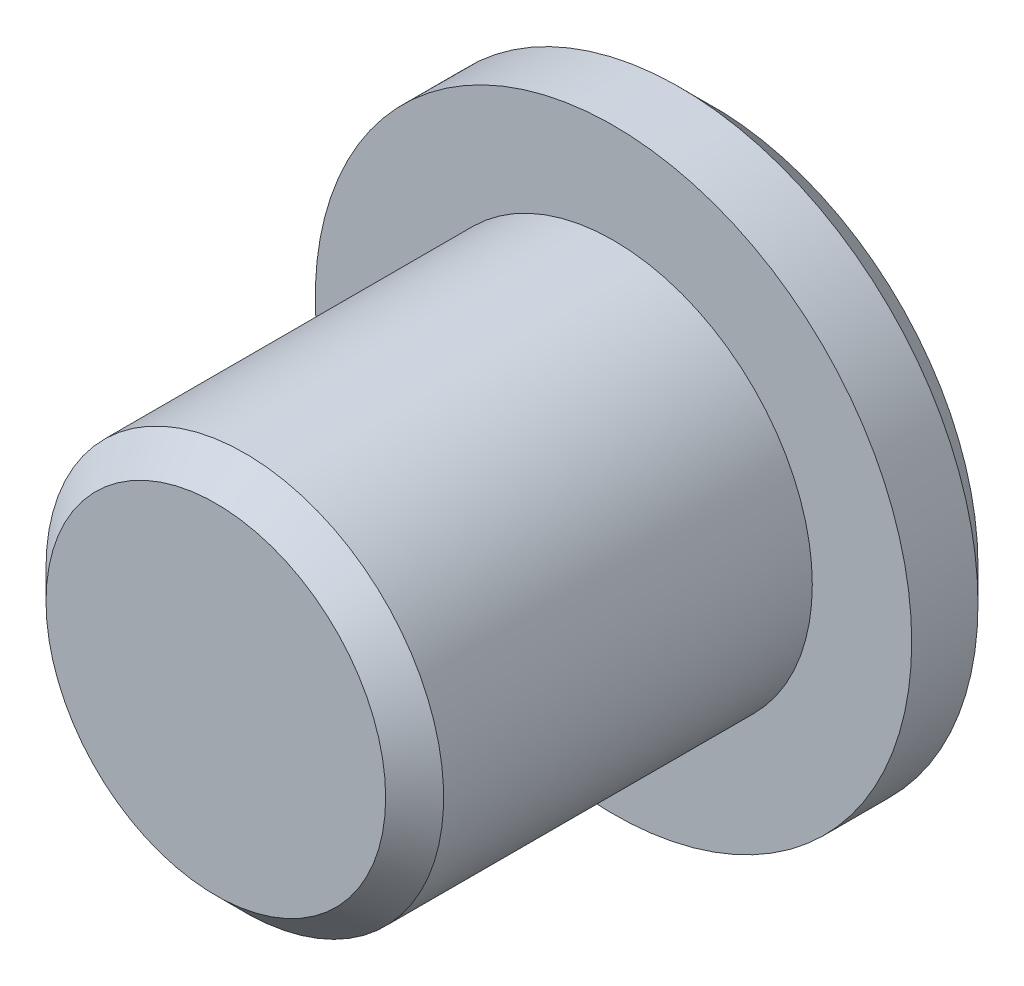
SolidWorks part; units mm, degrees
ref_plane "Plan de face" through (0, 0, 0) normal (0, 0, 1) x (1, 0, 0)
ref_plane "Plan de dessus" through (0, 0, 0) normal (0, 1, 0) x (1, 0, 0)
ref_plane "Plan de droite" through (0, 0, 0) normal (1, 0, 0) x (0, 0, -1)
sketch "Esquisse1" plane through (0, 0, 0) normal (0, 0, 1) x (1, 0, 0)
  circle A0 centre (0, 0) radius 9
  dimension "D1" = 18
extrude "Extrusion1" add sketch "Esquisse1" along normal blind 3
sketch "Esquisse2" plane through (0, 0, 3) normal (0, 0, 1) x (1, 0, 0)
  circle A0 centre (0, 0) radius 6
  dimension "D1" = 12
extrude "Extrusion2" add sketch "Esquisse2" along normal blind 12
chamfer "Chanfrein1" distance 0.875 angle 45 1 edges at (6, 0, 15)
chamfer "Chanfrein2" distance 1 angle 45 1 edges at (9, 0, 0)
hole_wizard "Diamètre du perçage Ø6.0 (6)1" positions "Esquisse4" profile "Esquisse3" hole size "Ø6.0" standard "ISO"
sketch "Esquisse4" plane through (0, 0, 0) normal (0, 0, -1) x (-1, 0, 0)
  point P0 (0, 0)
sketch "Esquisse3" plane through (0, 0, 0) normal (1, 0, 0) x (0, 1, 0)
  line L0 (0, 0) -> (0, 7.8026)
  line L1 (0, 7.8026) -> (3, 6)
  line L2 (3, 6) -> (3, 0)
  line L5 (3, 0) -> (0, 0)
  line L10 (0, 7.8026) -> (-3, 6) construction
  line L11 (0, -6.35) -> (0, 107.95) construction
  dimension "Diamètre du perçage" = 6
  dimension "Profondeur du perçage" = 6
  dimension "Angle de pointe" = 118
sketch "Esquisse5" plane through (0, 0, 0) normal (0, 0, -1) x (-1, 0, 0)
  line L0 (8.25, 0) -> (-8.25, 0) construction
  line L1 (1.7321, 3) -> (-1.7321, 3)
  line L2 (-1.7321, 3) -> (-3.4641, 0)
  line L3 (-3.4641, 0) -> (-1.7321, -3)
  line L4 (-1.7321, -3) -> (1.7321, -3)
  line L5 (1.7321, -3) -> (3.4641, 0)
  line L6 (3.4641, 0) -> (1.7321, 3)
  circle A0 centre (0, 0) radius 3 construction
  dimension "D1" = 6
extrude "Extrusion3" cut sketch "Esquisse5" against normal blind 6
sketch "Esquisse7" plane through (0, 0, 0) normal (0, 1, 0) x (1, 0, 0)
  line L0 (3.4641, 0) -> (0, 0)
  line L1 (3.4641, 0) -> (0, -3.4641)
  line L2 (0, 0) -> (0, -9.7094) construction
  line L3 (0, 0) -> (0, -3.4641)
  dimension "D1" = 45
revolve "Enlèvement de matière-Révolution1" cut sketch "Esquisse7" angle 360 about L2
